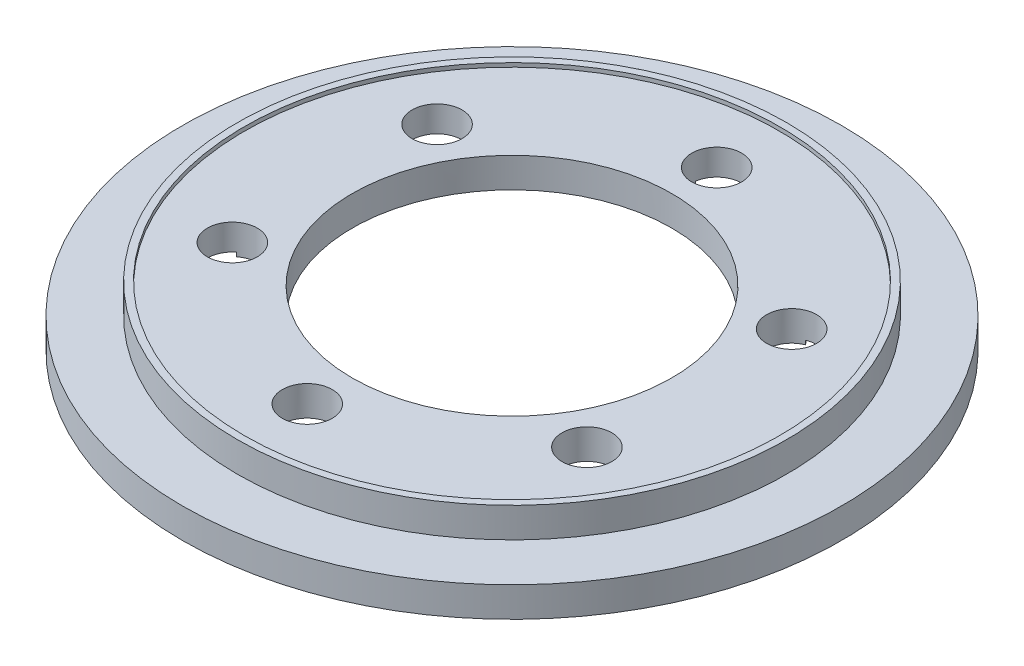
SolidWorks part; units mm, degrees
ref_plane "Front Plane" through (0, 0, 0) normal (0, 0, 1) x (1, 0, 0)
ref_plane "Top Plane" through (0, 0, 0) normal (0, 1, 0) x (1, 0, 0)
ref_plane "Right Plane" through (0, 0, 0) normal (1, 0, 0) x (0, 0, -1)
sketch "Sketch1" plane through (0, 0, 0) normal (0, 1, 0) x (1, 0, 0)
  circle A0 centre (0, 0) radius 16.5
  dimension "D1" = 33
extrude "Boss-Extrude1" add sketch "Sketch1" along normal blind 1.5
sketch "Sketch2" plane through (0, 1.5, 0) normal (0, 1, 0) x (1, 0, 0)
  circle A0 centre (0, 0) radius 13.75
  dimension "D1" = 27.5
extrude "Boss-Extrude2" add sketch "Sketch2" along normal blind 1.5
sketch "Sketch3" plane through (0, 0, 0) normal (0, -1, 0) x (1, 0, 0)
  circle A0 centre (0, 0) radius 15.5
  dimension "D1" = 31
extrude "Cut-Extrude1" cut sketch "Sketch3" against normal blind 1
sketch "Sketch4" plane through (0, 3, 0) normal (0, 1, 0) x (1, 0, 0)
  circle A0 centre (0, 0) radius 8
  dimension "D1" = 16
extrude "Cut-Extrude2" cut sketch "Sketch4" against normal through all
sketch "Sketch5" plane through (0, 1, 0) normal (0, -1, 0) x (1, 0, 0)
  circle A0 centre (0, 0) radius 12.5
  dimension "D1" = 25
extrude "Cut-Extrude3" cut sketch "Sketch5" against normal blind 0.5
sketch "Sketch6" plane through (0, 3, 0) normal (0, 1, 0) x (1, 0, 0)
  circle A0 centre (0, 10.25) radius 1.25
  dimension "D1" = 2.5
  dimension "D2" = 10.25
sketch "Sketch7" plane through (0, 3, 0) normal (0, 1, 0) x (1, 0, 0)
  circle A0 centre (0, 0) radius 13.4
  dimension "D1" = 26.8
extrude "Cut-Extrude5" cut sketch "Sketch7" against normal blind 0.2
sketch "Sketch8" plane through (0, 1.5, 0) normal (0, -1, 0) x (1, 0, 0)
  circle A0 centre (0, 0) radius 10.5
  circle A1 centre (0, 0) radius 8
  dimension "D1" = 21
extrude "Boss-Extrude3" add sketch "Sketch8" along normal blind 0.2
extrude "Cut-Extrude6" cut sketch "Sketch6" against normal through all
pattern_circular "CirPattern3" count 6 over 360 about axis through (0, 0, 0) along (0, 1, 0) of "Cut-Extrude6"
